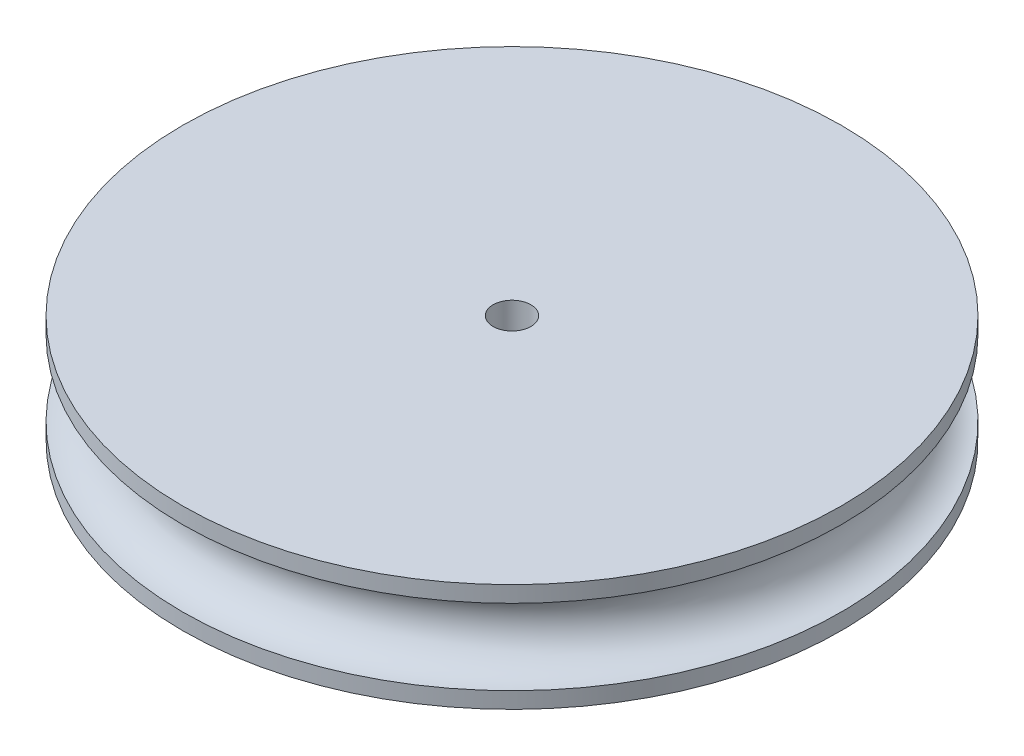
SolidWorks part; units mm, degrees
ref_plane "Front Plane" through (0, 0, 0) normal (0, 0, 1) x (1, 0, 0)
ref_plane "Top Plane" through (0, 0, 0) normal (0, 1, 0) x (1, 0, 0)
ref_plane "Right Plane" through (0, 0, 0) normal (1, 0, 0) x (0, 0, -1)
sketch "Sketch1" plane through (0, 0, 0) normal (0, 1, 0) x (1, 0, 0)
  circle A0 centre (0, 0) radius 7.366 construction
  ellipse E0 centre (0, 0) end of major axis (-9.779, 0) minor radius 7.366
  dimension "D1" = 14.732
  dimension "D2" = 19.558
extrude "Boss-Extrude1" add sketch "Sketch1" along normal blind 24.892
fillet "Fillet1" radius 2.54 2 edges at (-9.779, 0, 0) (-9.779, 24.892, 0)
sketch "Sketch2" plane through (0, 24.892, 0) normal (0, 1, 0) x (1, 0, 0)
  circle A0 centre (0, 0) radius 2.921
  dimension "D1" = 5.842
extrude "Boss-Extrude2" add sketch "Sketch2" along normal blind 1.27
sketch "Sketch3" plane through (0, 26.162, 0) normal (0, 1, 0) x (1, 0, 0)
  circle A0 centre (0, 0) radius 2.794
  dimension "D1" = 5.588
extrude "Cut-Extrude1" cut sketch "Sketch3" against normal blind 0.0635
sketch "Sketch4" plane through (0, 26.0985, 0) normal (0, 1, 0) x (1, 0, 0)
  circle A0 centre (0, 0) radius 0.127
  dimension "D1" = 0.254
extrude "Boss-Extrude3" add sketch "Sketch4" along normal blind 6.35
sketch "Sketch5" plane through (0, 0, 0) normal (0, -1, 0) x (1, 0, 0)
  line L0 (-2.6027, 4.064) -> (2.6027, 4.064)
  circle A0 centre (0, 0) radius 4.826
  dimension "D1" = 9.652
  dimension "D2" = 4.064
extrude "Boss-Extrude4" add sketch "Sketch5" along normal blind 1.905 contours L0 A0
chamfer "Chamfer1" distance 0.635 angle 45 1 edges at (0, -1.905, -4.826)
ref_plane "Wheel Height" through (0, 27.432, 0) normal (0, 1, 0) x (1, 0, 0)
sketch "Sketch6" plane through (0, 27.432, 0) normal (0, 1, 0) x (1, 0, 0)
  circle A0 centre (0, 0) radius 0.254
  circle A1 centre (0, 0) radius 15.494
  dimension "D1" = 0.508
  dimension "D2" = 30.988
extrude "Boss-Extrude5" add sketch "Sketch6" along normal blind 5.08 separate body
ref_axis "Axis1" through (0, 32.4485, 0) along (0, -1, 0)
sketch "Sketch7" plane through (0, 0, 0) normal (0, 0, 1) x (1, 0, 0)
  line L0 (15.494, 27.432) -> (15.494, 32.512) construction
  circle A0 centre (15.494, 29.972) radius 2.54 construction
  circle A1 centre (15.494, 29.972) radius 1.778
  dimension "D1" = 5.08
  dimension "D2" = 3.556
revolve "Cut-Revolve1" cut sketch "Sketch7" angle 360 about axis through (0, 32.4485, 0) along (0, -1, 0)
sketch "Sketch8" plane through (0, 27.432, 0) normal (0, -1, 0) x (1, 0, 0)
  circle A1 centre (0, 0) radius 15.494
  circle A2 centre (0, 0) radius 15.494
  dimension "D1" = 0
extrude "Cut-Extrude2" cut sketch "Sketch8" along normal through all
sketch "Sketch9" plane through (0, 27.432, 0) normal (0, -1, 0) x (1, 0, 0)
  circle A0 centre (0, 0) radius 0.889
  dimension "D1" = 1.778
extrude "Cut-Extrude3" cut sketch "Sketch9" against normal through all
